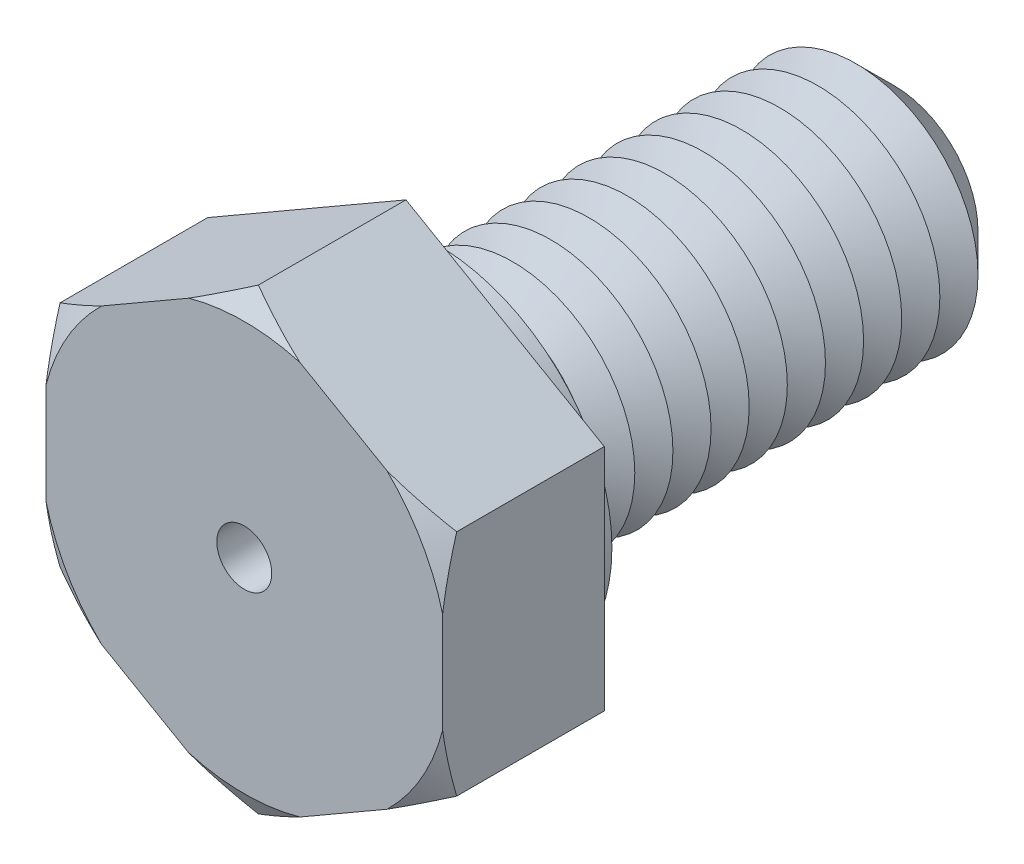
SolidWorks part; units mm, degrees
ref_plane "Front Plane" through (0, 0, 0) normal (0, 0, 1) x (1, 0, 0)
ref_plane "Top Plane" through (0, 0, 0) normal (0, 1, 0) x (1, 0, 0)
ref_plane "Right Plane" through (0, 0, 0) normal (1, 0, 0) x (0, 0, -1)
sketch "Sketch2" plane through (0, 0, 0) normal (0, 0, 1) x (1, 0, 0)
  line L1 (0, 7.5056) -> (-6.5, 3.7528)
  line L2 (-6.5, 3.7528) -> (-6.5, -3.7528)
  line L3 (-6.5, -3.7528) -> (0, -7.5056)
  line L4 (0, -7.5056) -> (6.5, -3.7528)
  line L5 (6.5, -3.7528) -> (6.5, 3.7528)
  line L6 (6.5, 3.7528) -> (0, 7.5056)
  circle A0 centre (0, 0) radius 6.5 construction
  dimension "D1" = 13
extrude "Boss-Extrude1" add sketch "Sketch2" along normal blind 5.3
sketch "Sketch3" plane through (0, 0, 0) normal (0, 0, -1) x (-1, 0, 0)
  circle A0 centre (0, 0) radius 4
  dimension "D1" = 8
extrude "Boss-Extrude2" add sketch "Sketch3" along normal blind 16
sketch "Sketch4" plane through (0, 0, 0) normal (0, 0, -1) x (-1, 0, 0)
  circle A0 centre (0, 0) radius 5.75
  dimension "D1" = 11.5
extrude "Boss-Extrude3" add sketch "Sketch4" along normal blind 1
sketch "Sketch5" plane through (0, 0, 0) normal (1, 0, 0) x (0, 0, -1)
  line L0 (-3.2117, 0) -> (6.3192, 0) construction
chamfer "Chamfer1" distance 1.25 angle 45 1 edges at (-4, 0, -16)
sketch "Sketch6" plane through (0, 0, 0) normal (1, 0, 0) x (0, 0, -1)
  line L0 (1, 4) -> (1.625, 2.9175)
  line L1 (1.625, 2.9175) -> (2.25, 4)
  line L2 (14.75, 4) -> (1, 4) construction
  line L3 (2.25, 4) -> (1, 4)
  dimension "D1" = 1.25
revolve "Cut-Revolve1" cut sketch "Sketch6" angle 360 about L0
pattern_linear "LPattern1" count 11 spacing 1.25 along (0, 0, -1) of "Cut-Revolve1"
sketch "Sketch7" plane through (0, 0, 0) normal (1, 0, 0) x (0, 0, -1)
  line L0 (-5.3, 7.5056) -> (-5.3, 6.7056)
  line L1 (-5.3, 3.7528) -> (-5.3, 7.5056) construction
  line L2 (-5.3, 6.7056) -> (-4.8381, 7.5056)
  line L3 (-5.3, 7.5056) -> (0, 7.5056) construction
  line L4 (-4.8381, 7.5056) -> (-5.3, 7.5056)
  dimension "D1" = 0.8
  dimension "D2" = 30
revolve "Cut-Revolve2" cut sketch "Sketch7" angle 360 about L0
sketch "Sketch8" plane through (0, 0, 5.3) normal (0, 0, 1) x (1, 0, 0)
  circle A0 centre (0, 0) radius 0.9
  dimension "D1" = 1.8
extrude "Cut-Extrude1" cut sketch "Sketch8" against normal up to surface (21.3 mm away)
